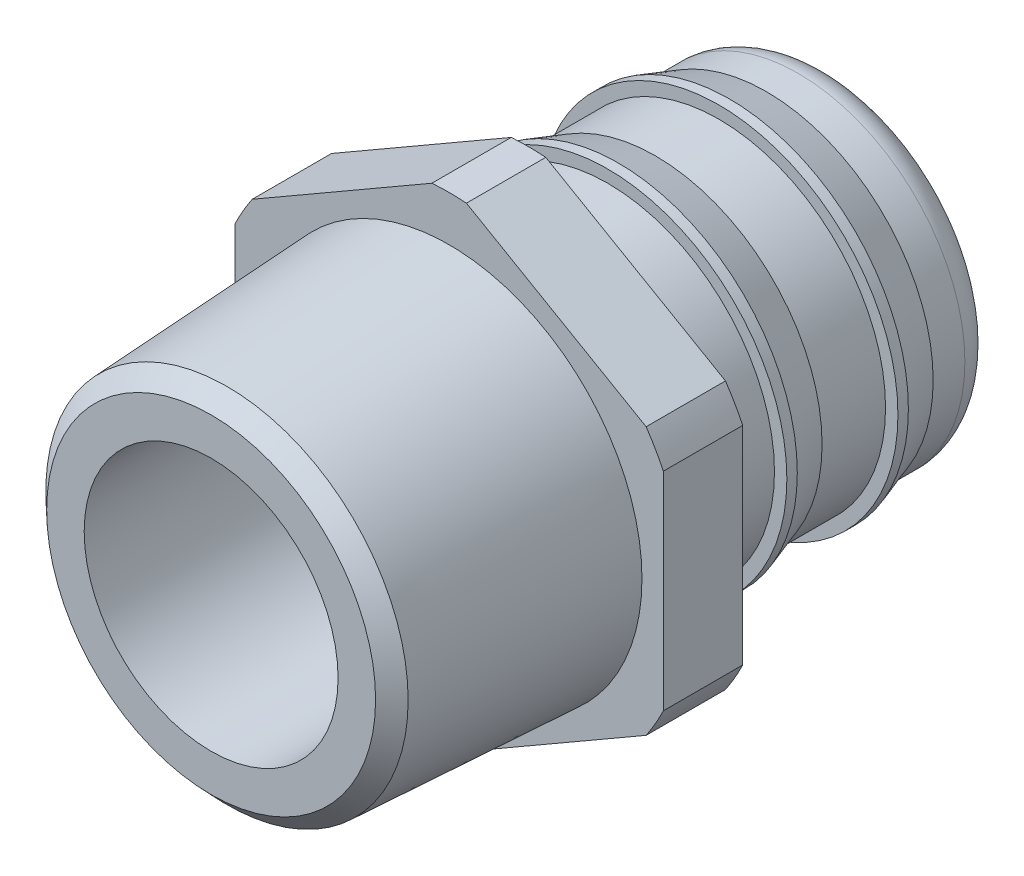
SolidWorks part; units mm, degrees
ref_plane "Plan de face" through (0, 0, 0) normal (0, 0, 1) x (1, 0, 0)
ref_plane "Plan de dessus" through (0, 0, 0) normal (0, 1, 0) x (1, 0, 0)
ref_plane "Plan de droite" through (0, 0, 0) normal (1, 0, 0) x (0, 0, -1)
sketch "Esquisse1" plane through (0, 0, 0) normal (1, 0, 0) x (0, 0, -1)
  line L0 (0, 0) -> (49, 0) construction
  line L1 (10, 8) -> (10, 10.3639)
  line L2 (42.6581, 11.2806) -> (42, 11.2806)
  line L3 (25, 12.15) -> (25, 15)
  line L4 (25, 15) -> (30, 15)
  line L5 (30, 15) -> (30, 10.5)
  line L6 (30, 10.5) -> (35, 10.5)
  line L7 (35, 10.5) -> (35, 11.2806)
  line L8 (35.6581, 11.2806) -> (38, 10.5)
  line L9 (38, 10.5) -> (42, 10.5)
  line L10 (42, 10.5) -> (42, 11.2806)
  line L11 (42.6581, 11.2806) -> (45, 10.5)
  line L12 (45, 10.5) -> (47, 10.5)
  line L13 (49, 8.5) -> (49, 8)
  line L15 (10.9986, 11.4162) -> (25, 12.15)
  line L16 (10, 10.3639) -> (10.9986, 11.4162)
  line L17 (10, 8) -> (49, 8)
  line L18 (35.6581, 11.2806) -> (35, 11.2806)
  arc A0 (49, 8.5) -> (47, 10.5) centre (47, 8.5) ccw
  point P5 (10, 11.3639)
  dimension "D16" = 2
  dimension "D17" = 0.6581
  dimension "D1" = 15
  dimension "D3" = 5
  dimension "D4" = 12
  dimension "D5" = 19
  dimension "D6" = 24.3
  dimension "D8" = 21
  dimension "D9" = 3
  dimension "D11" = 5
  dimension "D12" = 30
  dimension "D13" = 22.5613
  dimension "D14" = 10
  dimension "D15" = 1
  dimension "D19" = 8
  dimension "D23" = 16
  dimension "D18" = 0.6581
revolve "Révolution1" add sketch "Esquisse1" angle 360 about L0
sketch "Esquisse2" plane through (0, 0, -30) normal (0, 0, -1) x (-1, 0, 0)
  line L1 (13.5, -6.5383) -> (13.5, 6.5383)
  line L2 (12.4124, 8.4222) -> (1.0876, 14.9605)
  line L3 (-1.0876, 14.9605) -> (-12.4124, 8.4222)
  line L4 (-13.5, 6.5383) -> (-13.5, -6.5383)
  line L5 (-12.4124, -8.4222) -> (-1.0876, -14.9605)
  line L6 (1.0876, -14.9605) -> (12.4124, -8.4222)
  circle A0 centre (0, 0) radius 13.5 construction
  circle A1 centre (0, 0) radius 15 construction
  arc A2 (-1.0876, 14.9605) -> (-12.4124, 8.4222) centre (0, 0) ccw
  arc A3 (-13.5, 6.5383) -> (-13.5, -6.5383) centre (0, 0) ccw
  arc A4 (-12.4124, -8.4222) -> (-1.0876, -14.9605) centre (0, 0) ccw
  arc A5 (1.0876, -14.9605) -> (12.4124, -8.4222) centre (0, 0) ccw
  arc A6 (13.5, -6.5383) -> (13.5, 6.5383) centre (0, 0) ccw
  arc A7 (12.4124, 8.4222) -> (1.0876, 14.9605) centre (0, 0) ccw
  dimension "D1" = 27
extrude "Enlèv. mat.-Extru.1" cut sketch "Esquisse2" against normal through all
